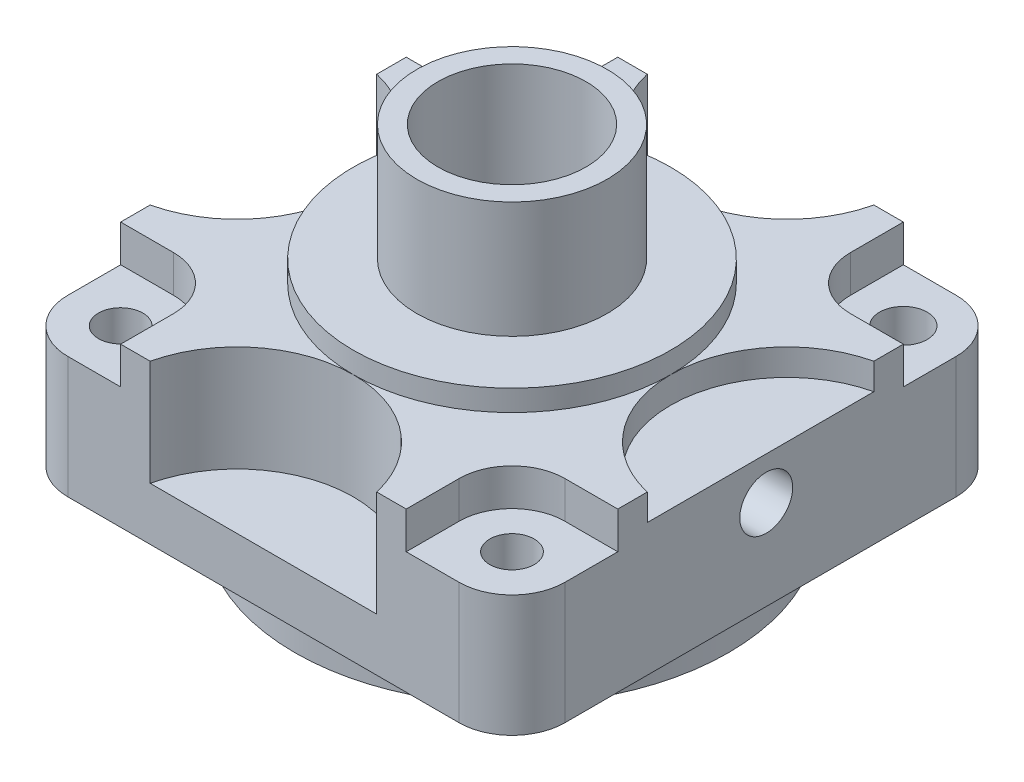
SolidWorks part; units mm, degrees
ref_plane "Plan de face" through (0, 0, 0) normal (0, 0, 1) x (1, 0, 0)
ref_plane "Plan de dessus" through (0, 0, 0) normal (0, 1, 0) x (1, 0, 0)
ref_plane "Plan de droite" through (0, 0, 0) normal (1, 0, 0) x (0, 0, -1)
sketch "Esquisse1" plane through (0, 0, 0) normal (0, 0, 1) x (1, 0, 0)
  line L1 (-23.5, 15) -> (23.5, 15)
  line L2 (-23.5, 15) -> (-23.5, 0)
  line L3 (-23.5, 0) -> (23.5, 0)
  line L4 (23.5, 15) -> (23.5, 0)
  dimension "D1" = 47
  dimension "D2" = 23.5
  dimension "D3" = 15
extrude "Extrusion1" add sketch "Esquisse1" along normal blind 47
sketch "Esquisse2" plane through (0, 0, 0) normal (0, -1, 0) x (1, 0, 0)
  circle A0 centre (0, 23.5285) radius 20.5
  dimension "D1" = 41
extrude "Extrusion2" add sketch "Esquisse2" along normal blind 5
sketch "Esquisse3" plane through (0, -5, 0) normal (0, -1, 0) x (1, 0, 0)
  circle A0 centre (0, 23.5285) radius 9.75
  dimension "D1" = 19.5
extrude "Extrusion3" add sketch "Esquisse3" along normal blind 3.5
sketch "Esquisse4" plane through (0, 15, 0) normal (0, 1, 0) x (-1, 0, 0)
  line L0 (-23.5, 47) -> (-23.5, 0) construction
  circle A0 centre (0, 23.5) radius 15
  dimension "D1" = 30
  dimension "D2" = 23.5
  dimension "D3" = 23.5
extrude "Extrusion4" add sketch "Esquisse4" along normal blind 2
sketch "Esquisse5" plane through (0, 17, 0) normal (0, 1, 0) x (-1, 0, 0)
  circle A0 centre (0, 23.5) radius 9
  dimension "D1" = 18
extrude "Extrusion5" add sketch "Esquisse5" along normal blind 11
sketch "Esquisse6" plane through (0, 28, 0) normal (0, 1, 0) x (-1, 0, 0)
  circle A0 centre (0, 23.5) radius 7
  dimension "D1" = 14
extrude "Enlèv. mat.-Extru.1" cut sketch "Esquisse6" against normal blind 13
sketch "Esquisse7" plane through (0, 15, 0) normal (0, 1, 0) x (-1, 0, 0)
  circle A0 centre (0, 23.5) radius 5.75
  dimension "D1" = 11.5
extrude "Enlèv. mat.-Extru.2" cut sketch "Esquisse7" against normal through all
sketch "Esquisse8" plane through (0, -8.5, 0) normal (0, -1, 0) x (1, 0, 0)
  circle A0 centre (0, 23.5285) radius 8.25
  dimension "D1" = 16.5
extrude "Enlèv. mat.-Extru.3" cut sketch "Esquisse8" against normal blind 17
sketch "Esquisse9" plane through (0, 15, 0) normal (0, 1, 0) x (-1, 0, 0)
  line L0 (0, -14.2918) -> (0, 143.899) construction
  line L1 (0, 23.5) -> (-77.8064, 23.5) construction
  line L2 (-23.5, 0) -> (23.5, 0) construction
  line L3 (23.5, 47) -> (23.5, 0) construction
  line L4 (0, 23.5) -> (84.5721, 23.5) construction
  line L5 (-23.5, 47) -> (23.5, 47) construction
  line L6 (-10.7121, 0) -> (10.7121, 0)
  line L13 (-10.7121, 47) -> (10.7121, 47)
  line L14 (23.5, 12.7879) -> (23.5, 34.2121)
  circle A2 centre (0, 23.5) radius 15 construction
  arc A3 (23.5, 34.2121) -> (23.5, 12.7879) centre (26, 23.5) ccw
  arc A4 (10.7121, 0) -> (-10.7121, 0) centre (0, -2.5) ccw
  arc A5 (-10.7121, 47) -> (10.7121, 47) centre (0, 49.5) ccw
  circle A6 centre (0, 23.5) radius 15 construction
  dimension "D1" = 22
  dimension "D2" = 22
  dimension "D3" = 22
extrude "Enlèv. mat.-Extru.4" cut sketch "Esquisse9" against normal blind 10
sketch "Esquisse10" plane through (0, 15, 0) normal (0, 1, 0) x (-1, 0, 0)
  line L0 (-23.5, 47) -> (-23.5, 0) construction
  line L4 (-23.5, 12.7879) -> (-23.5, 34.2121)
  line L5 (0, 23.5) -> (-76.4829, 23.5) construction
  arc A2 (-23.5, 12.7879) -> (-23.5, 34.2121) centre (-26, 23.5) ccw
  circle A4 centre (0, 23.5) radius 15 construction
  dimension "D1" = 22
extrude "Enlèv. mat.-Extru.5" cut sketch "Esquisse10" against normal blind 2.5
fillet "Congé1" radius 5 4 edges at (-23.5, 7.5, 47) (23.5, 7.5, 47) (23.5, 7.5, 0) (-23.5, 7.5, 0)
hole_wizard "Trou taraudé M63" positions "Esquisse3D1" profile "Esquisse11" tap size "M6" standard "ISO"
sketch3d "Esquisse3D1"
  line L0 (23.5, 0, 42) -> (23.5, 0, 5) construction
  line L1 (18.5, 15, 0) -> (18.5, 0, 0) construction
  point P0 (23.5, 8.5, 22.9619)
  point P11 (0, -12.364, -29.4152)
  dimension "D1" = 8.5
  dimension "D2" = 23.5
sketch "Esquisse11" plane through (23.5, 8.5, 22.9619) normal (0, 1, 0) x (0, 0, -1)
  line L0 (0, 0) -> (0, 12.5022)
  line L1 (0, 12.5022) -> (2.5, 11)
  line L2 (2.5, 11) -> (2.5, 0)
  line L5 (2.5, 0) -> (0, 0)
  line L10 (0, 12.5022) -> (-2.5, 11) construction
  line L11 (0, -6.35) -> (0, 107.95) construction
  dimension "Diamètre du trou pour taraudage" = 5
  dimension "Profondeur du trou pour taraudage" = 11
  dimension "Angle de pointe" = 118
sketch "Esquisse12" plane through (0, 15, 0) normal (0, 1, 0) x (-1, 0, 0)
  line L0 (-18.5, -19.8609) -> (-18.5, 147.4969) construction
  line L1 (-77.3053, 42) -> (75.0437, 42) construction
  line L2 (-77.3053, 5) -> (73.399, 5) construction
  line L3 (18.5, -17.0081) -> (18.5, 151.795) construction
  circle A0 centre (0, 23.5) radius 5.75 construction
  circle A1 centre (-18.5, 5) radius 2.25
  circle A2 centre (-18.5, 42) radius 2.1
  circle A4 centre (18.5, 42) radius 2.1
  circle A5 centre (18.5, 5) radius 2.1
  dimension "D5" = 4.5
  dimension "D6" = 4.2
  dimension "D7" = 4.2
  dimension "D8" = 4.2
  dimension "D1" = 18.5
  dimension "D2" = 18.5
  dimension "D3" = 18.5
  dimension "D4" = 18.5
extrude "Enlèv. mat.-Extru.6" cut sketch "Esquisse12" against normal through all
sketch "Esquisse13" plane through (0, 15, 0) normal (0, 1, 0) x (1, 0, 0)
  line L0 (13.5, -42) -> (13.5, -47)
  line L1 (18.5, -47) -> (10.7121, -47) construction
  line L2 (13.5, -47) -> (18.5, -47)
  line L3 (18.5, -37) -> (23.5, -37)
  line L4 (23.5, -42) -> (23.5, -34.2121) construction
  line L5 (23.5, -37) -> (23.5, -42)
  line L6 (18.5, -10) -> (23.5, -10)
  line L7 (23.5, -12.7879) -> (23.5, -5) construction
  line L8 (23.5, -10) -> (23.5, -5)
  line L9 (13.5, -5) -> (13.5, 0)
  line L10 (18.5, 0) -> (10.7121, 0) construction
  line L11 (13.5, 0) -> (18.5, 0)
  line L12 (-13.5, -5) -> (-13.5, 0)
  line L13 (-10.7121, 0) -> (-18.5, 0) construction
  line L14 (-13.5, 0) -> (-18.5, 0)
  line L15 (-18.5, -10) -> (-23.5, -10)
  line L16 (-23.5, -12.7879) -> (-23.5, -5) construction
  line L17 (-23.5, -10) -> (-23.5, -5)
  line L18 (-13.5, -42) -> (-13.5, -47)
  line L19 (-10.7121, -47) -> (-18.5, -47) construction
  line L20 (-13.5, -47) -> (-18.5, -47)
  line L21 (-18.5, -37) -> (-23.5, -37)
  line L22 (-23.5, -42) -> (-23.5, -34.2121) construction
  line L23 (-23.5, -37) -> (-23.5, -42)
  arc A0 (18.5, -47) -> (23.5, -42) centre (18.5, -42) ccw
  arc A1 (23.5, -5) -> (18.5, 0) centre (18.5, -5) ccw
  arc A2 (-18.5, 0) -> (-23.5, -5) centre (-18.5, -5) ccw
  arc A3 (-13.5, -42) -> (-18.5, -37) centre (-18.5, -42) ccw
  arc A4 (18.5, -37) -> (13.5, -42) centre (18.5, -42) ccw
  arc A5 (13.5, -5) -> (18.5, -10) centre (18.5, -5) ccw
  arc A6 (-18.5, -10) -> (-13.5, -5) centre (-18.5, -5) ccw
  arc A7 (-23.5, -42) -> (-18.5, -47) centre (-18.5, -42) ccw
extrude "Extrusion11" cut sketch "Esquisse13" against normal blind 3.5
